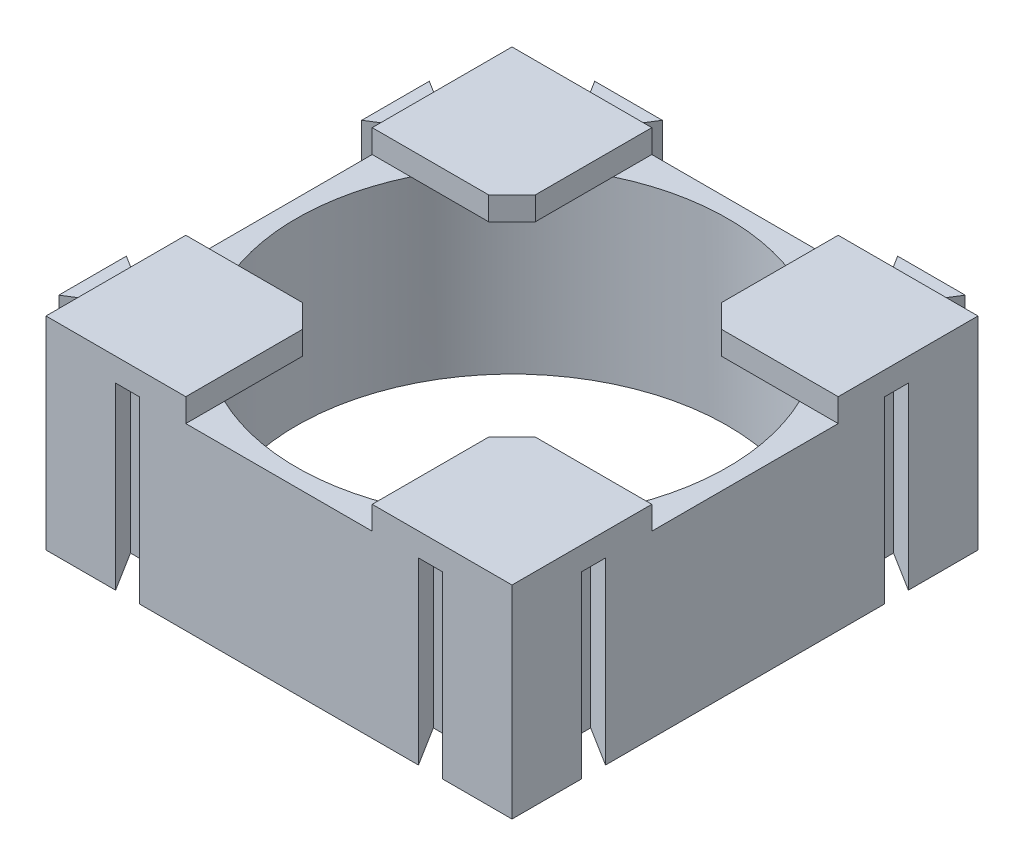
SolidWorks part; units mm, degrees
ref_plane "Front Plane" through (0, 0, 0) normal (0, 0, 1) x (1, 0, 0)
ref_plane "Top Plane" through (0, 0, 0) normal (0, 1, 0) x (1, 0, 0)
ref_plane "Right Plane" through (0, 0, 0) normal (1, 0, 0) x (0, 0, -1)
sketch "Sketch1" plane through (0, 0, 0) normal (0, 1, 0) x (1, 0, 0)
  line L0 (-7.0127, 10) -> (-7.95, 11.5)
  line L1 (-10, 10) -> (-7.0127, 10)
  line L2 (-10, 10) -> (-10, 7.0127)
  line L3 (-10, -10) -> (-7.0127, -10)
  line L4 (10, 10) -> (10, 7.0127)
  line L5 (-10, 10) -> (10, -10) construction
  line L6 (-10, -10) -> (10, 10) construction
  line L7 (-7.95, 11.5) -> (-5.05, 11.5)
  line L8 (-6.5, 11.5) -> (-6.5, -10) construction
  line L9 (0, 0) -> (0, 19.271) construction
  line L10 (0, -55) -> (0, 55) construction
  line L11 (-5.9873, 10) -> (-5.05, 11.5)
  line L12 (5.9873, 10) -> (5.05, 11.5)
  line L13 (7.95, 11.5) -> (5.05, 11.5)
  line L14 (7.0127, 10) -> (7.95, 11.5)
  line L15 (-10, -5.9873) -> (-11.5, -5.05)
  line L16 (-11.5, -7.95) -> (-11.5, -5.05)
  line L17 (-10, -7.0127) -> (-11.5, -7.95)
  line L18 (-11.5, 7.95) -> (-11.5, 5.05)
  line L19 (-10, 5.9873) -> (-11.5, 5.05)
  line L20 (-10, 7.0127) -> (-11.5, 7.95)
  line L21 (-5.9873, 10) -> (5.9873, 10)
  line L22 (7.0127, 10) -> (10, 10)
  line L23 (-10, 5.9873) -> (-10, -5.9873)
  line L24 (-10, -7.0127) -> (-10, -10)
  line L25 (-7.0127, -10) -> (-8.075, -8.3)
  line L26 (10, -5.9873) -> (8.3, -4.925)
  line L27 (8.3, -8.075) -> (8.3, -4.925)
  line L28 (7.0127, -10) -> (8.075, -8.3)
  line L29 (5.9873, -10) -> (4.925, -8.3)
  line L30 (-5.9873, -10) -> (-4.925, -8.3)
  line L31 (10, -7.0127) -> (8.3, -8.075)
  line L32 (10, 7.0127) -> (8.3, 8.075)
  line L33 (8.3, 8.075) -> (8.3, 4.925)
  line L34 (8.075, -8.3) -> (4.925, -8.3)
  line L35 (10, 5.9873) -> (8.3, 4.925)
  line L36 (-8.075, -8.3) -> (-4.925, -8.3)
  line L37 (-5.9873, -10) -> (5.9873, -10)
  line L38 (7.0127, -10) -> (10, -10)
  line L39 (10, -7.0127) -> (10, -10)
  line L40 (10, 5.9873) -> (10, -5.9873)
  circle A0 centre (0, 0) radius 9.25
  point P9 (-6.5, 11.5)
  point P23 (-6.5, 10)
  point P31 (0, 0)
  point P35 (-8.3108, -8.3)
  point P43 (-4.6892, -8.3)
  point P46 (8.3108, -8.3)
  point P47 (4.6892, -8.3)
  point P56 (0, 0)
  dimension "D1" = 18.5
  dimension "D2" = 20
  dimension "D3" = 20
  dimension "D4" = 6.5
  dimension "D5" = 1.5
  dimension "D6" = 1.45
  dimension "D7" = 58
  dimension "D8" = 2
  dimension "D9" = 2
extrude "Boss-Extrude1" add sketch "Sketch1" along normal blind 7.7
sketch "Sketch2" plane through (0, 7.7, 0) normal (0, 1, 0) x (1, 0, 0)
  line L0 (-5, -4) -> (-4, -5)
  line L1 (-10, -10) -> (-4, -10)
  line L2 (-10, -10) -> (-10, -4)
  line L3 (-10, -4) -> (-5, -4)
  line L4 (-4, -10) -> (-4, -5)
  line L5 (-4, 10) -> (-4, 5)
  line L6 (-10, 10) -> (-4, 10)
  line L7 (-10, 10) -> (-10, 4)
  line L8 (-10, 4) -> (-5, 4)
  line L9 (-4, 5) -> (-5, 4)
  line L10 (10, 4) -> (5, 4)
  line L11 (10, 10) -> (10, 4)
  line L12 (10, 10) -> (4, 10)
  line L13 (4, 10) -> (4, 5)
  line L14 (5, 4) -> (4, 5)
  line L15 (4, -10) -> (4, -5)
  line L16 (10, -10) -> (4, -10)
  line L17 (10, -10) -> (10, -4)
  line L18 (10, -4) -> (5, -4)
  line L19 (4, -5) -> (5, -4)
  point P1 (-4, -4)
  point P25 (0, 0)
  dimension "D1" = 6
  dimension "D2" = 6
  dimension "D3" = 4
extrude "Boss-Extrude2" add sketch "Sketch2" along normal blind 1
